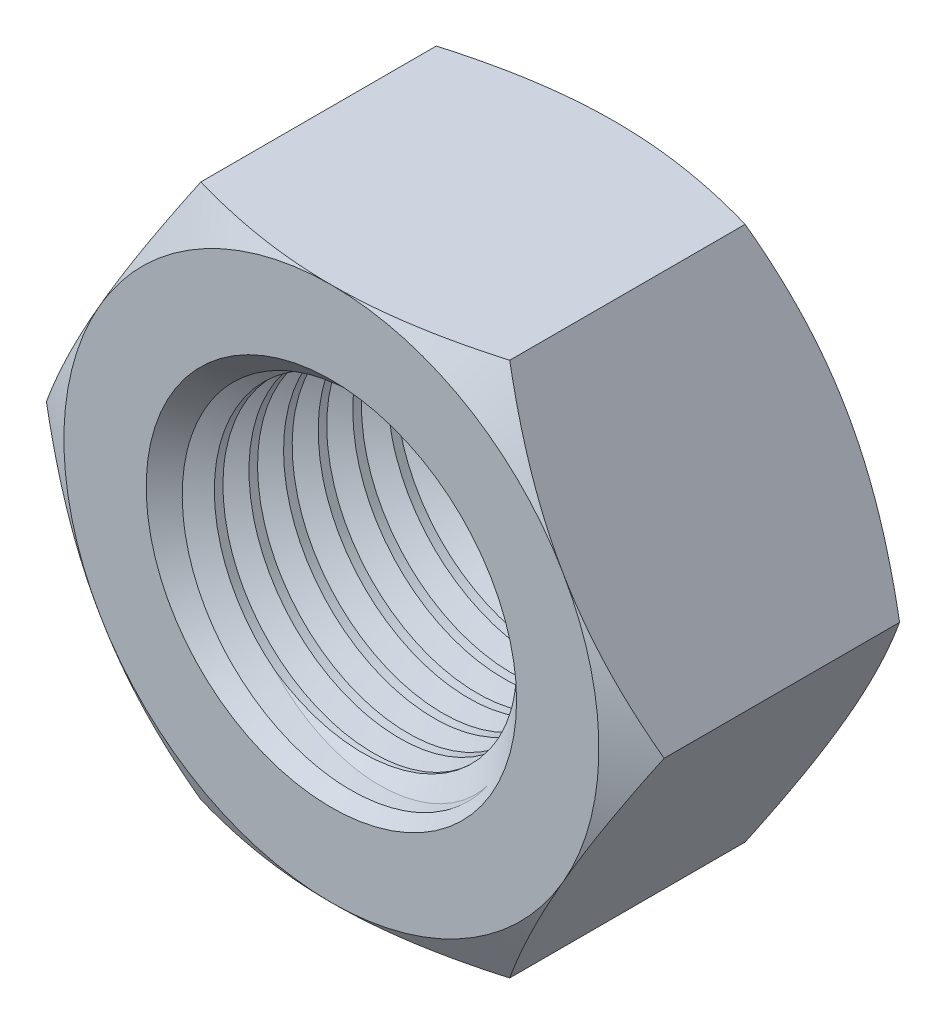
SolidWorks part; units mm, degrees
ref_plane "Front" through (0, 0, 0) normal (0, 0, 1) x (1, 0, 0)
ref_plane "Top" through (0, 0, 0) normal (0, 1, 0) x (1, 0, 0)
ref_plane "Right" through (0, 0, 0) normal (1, 0, 0) x (0, 0, -1)
sketch "Çizim1" plane through (0, 0, 0) normal (0, 0, 1) x (1, 0, 0)
  line L1 (49.0748, 0) -> (24.5374, 42.5)
  line L2 (24.5374, 42.5) -> (-24.5374, 42.5)
  line L3 (-24.5374, 42.5) -> (-49.0748, 0)
  line L4 (-49.0748, 0) -> (-24.5374, -42.5)
  line L5 (-24.5374, -42.5) -> (24.5374, -42.5)
  line L6 (24.5374, -42.5) -> (49.0748, 0)
  circle A0 centre (0, 0) radius 42.5 construction
  point P1 (0, 0)
  dimension "D1" = 85
extrude "Yükseklik-Ekstrüzyon1" add sketch "Çizim1" along normal blind 45
sketch "Çizim2" plane through (0, 0, 45) normal (0, 0, 1) x (1, 0, 0)
  circle A0 centre (0, 0) radius 42.5
extrude "Kes-Ekstrüzyon1" cut sketch "Çizim2" against normal blind 45 draft 60 flip side to cut
sketch "Çizim3" plane through (0, 0, 0) normal (0, 0, -1) x (-1, 0, 0)
  circle A0 centre (0, 0) radius 42.5
extrude "Kes-Ekstrüzyon2" cut sketch "Çizim3" against normal blind 45 draft 60 flip side to cut
sketch "Çizim4" plane through (0, 0, 45) normal (0, 0, 1) x (1, 0, 0)
  circle A0 centre (0, 0) radius 24.425
  dimension "D1" = 48.85
extrude "Kes-Ekstrüzyon3" cut sketch "Çizim4" against normal blind 45
chamfer "Pah1" distance 5 angle 45 2 edges at (24.425, 0, 0) (24.425, 0, 45)
sketch "Çizim5" plane through (0, 0, 0) normal (0, 0, -1) x (-1, 0, 0)
  circle A0 centre (0, 0) radius 24.425
curve "Helis/Spiral1"
ref_plane "Düzlem1" through (20.5476, 13.2052, 50) normal (-0.5403, 0.8407, 0.0358) x (0.8415, 0.5398, 0.023)
sketch "Çizim6" plane through (20.5476, 13.2052, 50) normal (-0.5403, 0.8407, 0.0358) x (0.8415, 0.5398, 0.023)
  line L0 (-1.2532, 2.7875) -> (-1.2532, -2.7875)
  line L1 (3.575, 0) -> (-1.2532, 2.7875)
  line L3 (-1.2532, -2.7875) -> (3.575, 0)
  line L5 (-1.7875, 3.096) -> (-1.7875, 0)
  circle A0 centre (0, 0) radius 1.7875 construction
  dimension "D1" = 3.575
sweep "Kes-Süpür1" cut profiles "Çizim6" path "Helis/Spiral1"
